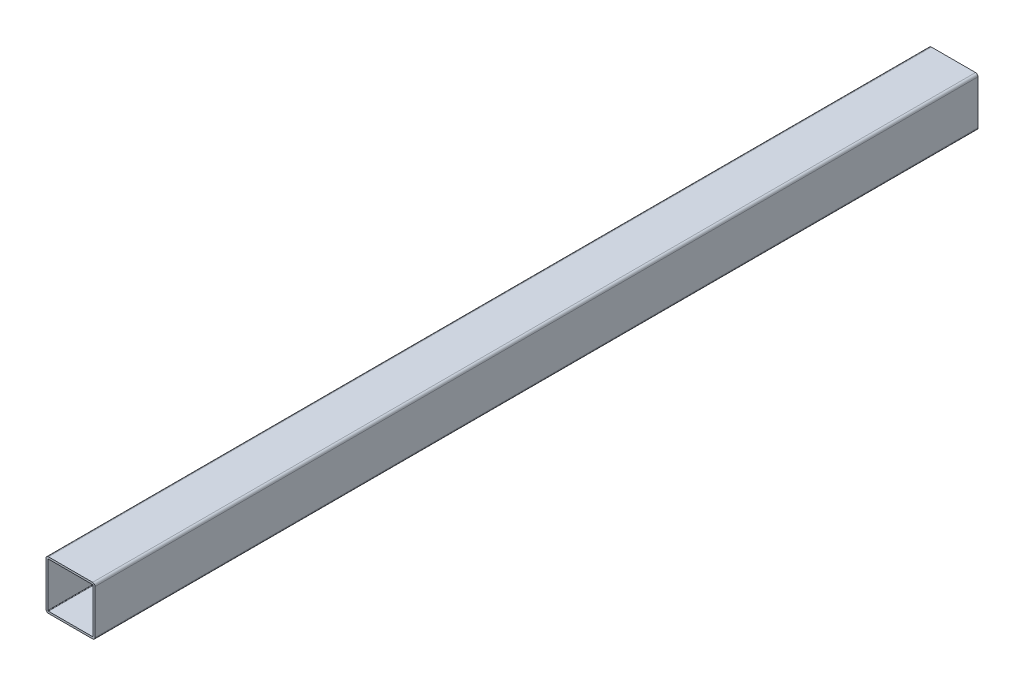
SolidWorks part; units mm, degrees
ref_plane "Face" through (0, 0, 0) normal (0, 0, 1) x (1, 0, 0)
ref_plane "Dessus" through (0, 0, 0) normal (0, 1, 0) x (1, 0, 0)
ref_plane "Droite" through (0, 0, 0) normal (1, 0, 0) x (0, 0, -1)
sketch "Esquisse1" plane through (0, 0, 0) normal (0, 0, 1) x (1, 0, 0)
  line L0 (5, -4) -> (95, -4)
  line L1 (5, 0) -> (95, 0)
  line L2 (0, -5) -> (0, -95)
  line L3 (5, -100) -> (95, -100)
  line L4 (100, -5) -> (100, -95)
  line L5 (96, -5) -> (96, -95)
  line L6 (5, -96) -> (95, -96)
  line L7 (4, -5) -> (4, -95)
  arc A0 (100, -5) -> (95, 0) centre (95, -5) ccw
  arc A1 (95, -100) -> (100, -95) centre (95, -95) ccw
  arc A2 (5, -100) -> (0, -95) centre (5, -95) cw
  arc A3 (5, 0) -> (0, -5) centre (5, -5) ccw
  arc A4 (96, -5) -> (95, -4) centre (95, -5) ccw
  arc A5 (95, -96) -> (96, -95) centre (95, -95) ccw
  arc A6 (5, -96) -> (4, -95) centre (5, -95) cw
  arc A7 (5, -4) -> (4, -5) centre (5, -5) ccw
  point P7 (100, 0)
  point P12 (0, -100)
  point P15 (0, 0)
  dimension "D3" = 5
  dimension "D1" = 100
  dimension "D2" = 100
  dimension "D4" = 4
extrude "Base-Extrusion" add sketch "Esquisse1" along normal blind 1800
